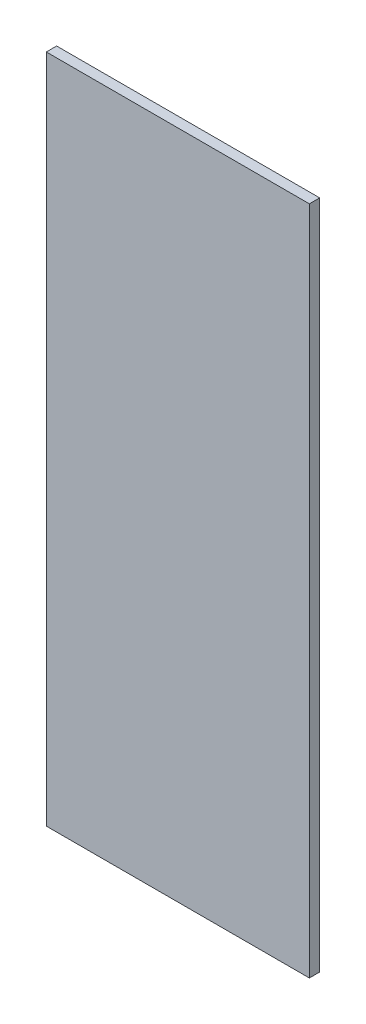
SolidWorks part; units mm, degrees
ref_plane "Face" through (0, 0, 0) normal (0, 0, 1) x (1, 0, 0)
ref_plane "Dessus" through (0, 0, 0) normal (0, 1, 0) x (1, 0, 0)
ref_plane "Droite" through (0, 0, 0) normal (1, 0, 0) x (0, 0, -1)
sketch "Esquisse1" plane through (0, 0, 0) normal (0, 0, 1) x (1, 0, 0)
  line L0 (127.5, -325) -> (-127.5, 325) construction
  line L1 (127.5, -325) -> (-127.5, -325)
  line L2 (127.5, -325) -> (127.5, 325)
  line L3 (127.5, 325) -> (-127.5, 325)
  line L4 (-127.5, -325) -> (-127.5, 325)
  dimension "D1" = 255
  dimension "D2" = 650
extrude "Base-Extrusion" add sketch "Esquisse1" along normal blind 10
